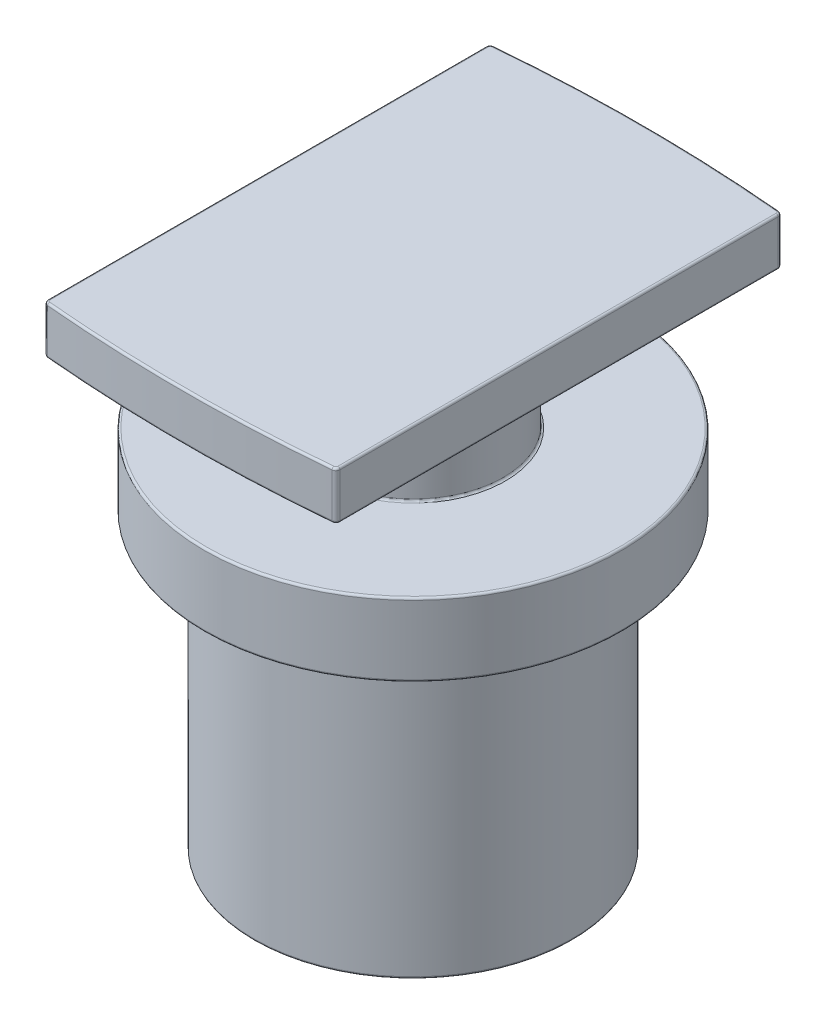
SolidWorks part; units mm, degrees
ref_plane "Płaszczyzna przednia" through (0, 0, 0) normal (0, 0, 1) x (1, 0, 0)
ref_plane "Płaszczyzna górna" through (0, 0, 0) normal (0, 1, 0) x (1, 0, 0)
ref_plane "Płaszczyzna prawa" through (0, 0, 0) normal (1, 0, 0) x (0, 0, -1)
sketch "Szkic1" plane through (0, 0, 0) normal (0, 1, 0) x (1, 0, 0)
  circle A0 centre (0, 0) radius 7.625
extrude "Dodanie-wyciągnięcie1" add sketch "Szkic1" along normal blind 14
sketch "Szkic2" plane through (0, 14, 0) normal (0, 1, 0) x (1, 0, 0)
  circle A0 centre (0, 0) radius 10
extrude "Dodanie-wyciągnięcie2" add sketch "Szkic2" along normal blind 3.5
sketch "Szkic3" plane through (0, 17.5, 0) normal (0, 1, 0) x (1, 0, 0)
  circle A0 centre (0, 0) radius 4.33
extrude "Dodanie-wyciągnięcie3" add sketch "Szkic3" along normal blind 4.8
sketch "Szkic4" plane through (0, 22.3, 0) normal (0, 1, 0) x (1, 0, 0)
  line L0 (-7, 0) -> (7, 0) construction
  line L2 (7, -10.4958) -> (7, 10.4958)
  line L4 (-7, -10.4958) -> (-7, 10.4958)
  line L5 (7, -10.6784) -> (-7, 10.6784) construction
  line L6 (7, 10.6784) -> (-7, -10.6784) construction
  arc A0 (-6.8179, 10.695) -> (6.8179, 10.695) centre (0, -65.3428) cw
  arc A1 (-6.8179, -10.695) -> (6.8179, -10.695) centre (0, 65.3428) ccw
  arc A2 (-6.8179, -10.695) -> (-7, -10.4958) centre (-6.8, -10.4958) cw
  arc A3 (6.8179, -10.695) -> (7, -10.4958) centre (6.8, -10.4958) ccw
  arc A4 (7, 10.4958) -> (6.8179, 10.695) centre (6.8, 10.4958) ccw
  arc A5 (-6.8179, 10.695) -> (-7, 10.4958) centre (-6.8, 10.4958) ccw
  point P0 (0, 0)
  point P8 (0, 11)
  point P12 (0, -11)
  dimension "D3" = 0.2
  dimension "D1" = 22
  dimension "D2" = 14
extrude "Dodanie-wyciągnięcie4" add sketch "Szkic4" along normal blind 2.3
sketch "Szkic5" plane through (0, 0, 0) normal (0, 0, 1) x (1, 0, 0)
  line L0 (0, 22.3) -> (0, 17.5) construction
  line L1 (-4.33, 22.3) -> (-5.33, 22.3)
  line L2 (-4.33, 22.3) -> (-4.33, 20.3)
  line L3 (-4.33, 20.3) -> (-5.33, 20.3)
  line L4 (-5.33, 22.3) -> (-5.33, 20.3)
  line L5 (-4.33, 22.3) -> (4.33, 22.3) construction
  line L6 (10, 17.5) -> (-10, 17.5) construction
  dimension "D1" = 2
  dimension "D2" = 1
revolve "Obrót1" add sketch "Szkic5" angle 90 about L0
fillet "Zaokrąglenie1" radius 0.1 31 edges at (0, 17.5, 4.33) (-4.33, 21.3, 0) (0, 21.3, -4.33) (-3.0618, 20.3, -3.0618) (0, 0, 7.625) (0, 14, 7.625) (0, 14, 10) (0, 17.5, 10) (-5.33, 21.3, 0) (-3.7689, 20.3, -3.7689) (0, 21.3, -5.33) (0, 22.3, 11) (6.9476, 22.3, 10.6307) (7, 22.3, 0) (6.9476, 22.3, -10.6307) (0, 22.3, -11) (-6.9476, 22.3, -10.6307) (-7, 22.3, 0) (-6.9476, 22.3, 10.6307) (3.0618, 22.3, 3.0618) (-4.83, 22.3, 0) (-3.7689, 22.3, -3.7689) (0, 22.3, -4.83) (-7, 24.6, 0) (-6.9476, 24.6, -10.6307) (0, 24.6, -11) (6.9476, 24.6, -10.6307) (7, 24.6, 0) (6.9476, 24.6, 10.6307) (0, 24.6, 11) (-6.9476, 24.6, 10.6307)
sketch "Szkic7" plane through (0, 0, 0) normal (0, -1, 0) x (1, 0, 0)
  line L0 (-5.725, 2.1772) -> (-5.725, -2.1772)
  line L1 (0, 6.125) -> (0, -6.125) construction
  line L2 (5.725, 2.1772) -> (5.725, -2.1772)
  circle A2 centre (0, 0) radius 6.125
  arc A3 (-5.725, -2.1772) -> (5.725, -2.1772) centre (0, 0) ccw
  circle A5 centre (0, 0) radius 7.725 construction
  arc A6 (5.725, 2.1772) -> (-5.725, 2.1772) centre (0, 0) ccw
  dimension "D2" = 2
  dimension "D1" = 1.4
extrude "Wytnij-wyciągnięcie1" cut sketch "Szkic7" against normal up to surface (14 mm away)
